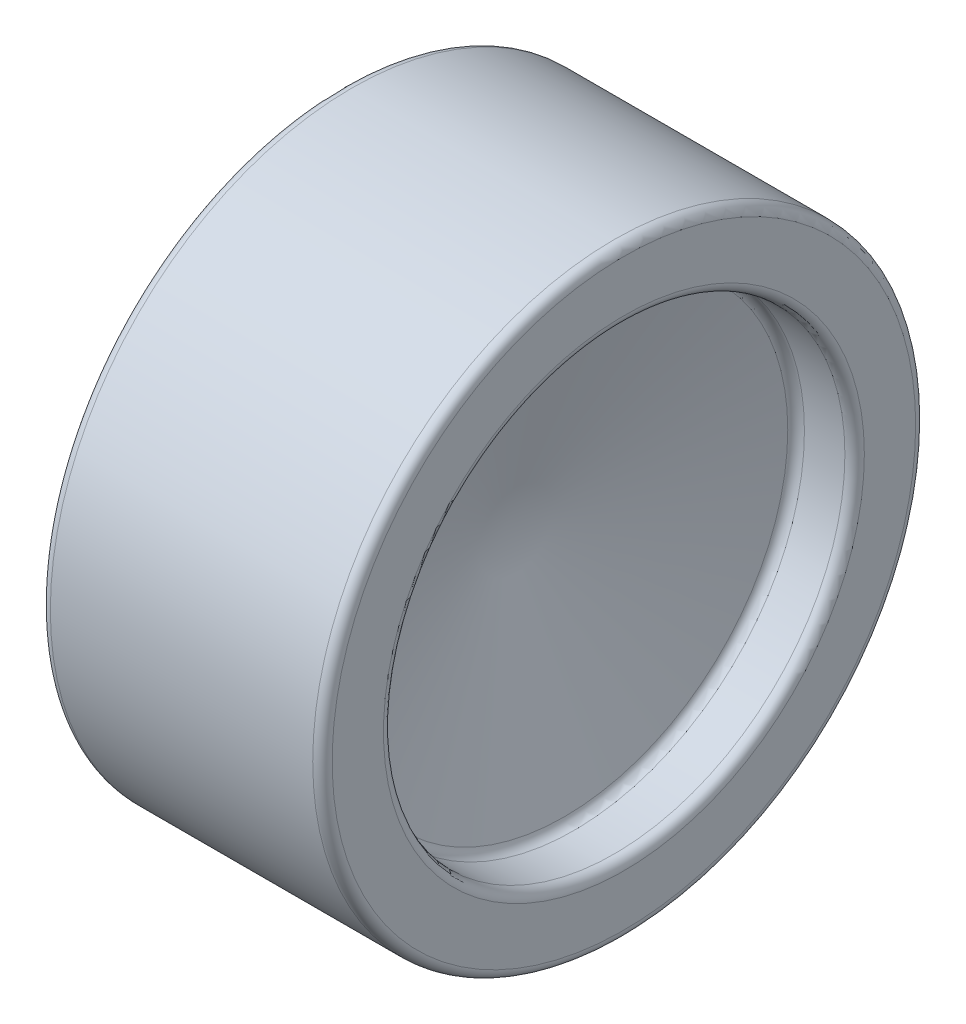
SolidWorks part; units mm, degrees
ref_plane "Front Plane" through (0, 0, 0) normal (0, 0, 1) x (1, 0, 0)
ref_plane "Top Plane" through (0, 0, 0) normal (0, 1, 0) x (1, 0, 0)
ref_plane "Right Plane" through (0, 0, 0) normal (1, 0, 0) x (0, 0, -1)
sketch "Sketch1" plane through (0, 0, 0) normal (1, 0, 0) x (0, 0, -1)
  circle A0 centre (0, 0) radius 310.007
  dimension "D1" = 620.014
extrude "Extrude1" add sketch "Sketch1" along normal blind 289.814
ref_axis "Axis1" through (289.814, 0, 0) along (-1, 0, 0)
sketch "Sketch2" plane through (0, 0, 0) normal (0, 1, 0) x (1, 0, 0)
  line L0 (168.4846, 0) -> (230.478, 237.2495)
  line L1 (289.814, 0) -> (0, 0) construction
  line L2 (289.814, -310.007) -> (289.814, 310.007) construction
  line L3 (289.814, 237.2495) -> (289.814, 0)
  line L4 (289.814, 0) -> (168.4846, 0)
  line L5 (230.478, 237.2495) -> (289.814, 237.2495)
  line L6 (0, 310.007) -> (0, -310.007) construction
  line L7 (0, 237.2495) -> (95.469, 237.2495)
  line L8 (0, 237.2495) -> (0, 106.1842)
  line L9 (0, 106.1842) -> (95.469, 106.1842)
  line L10 (95.469, 237.2495) -> (95.469, 106.1842)
revolve "Cut-Revolve1" cut sketch "Sketch2" angle 360 about axis through (289.814, 0, 0) along (-1, 0, 0)
fillet "Fillet1" radius 10 8 edges at (0, 0, -310.007) (289.814, 0, -310.007) (289.814, 0, -237.2495) (230.478, 0, -237.2495) (0, 0, -106.1842) (95.469, 0, -106.1842) (95.469, 0, -237.2495) (0, 0, -237.2495)
